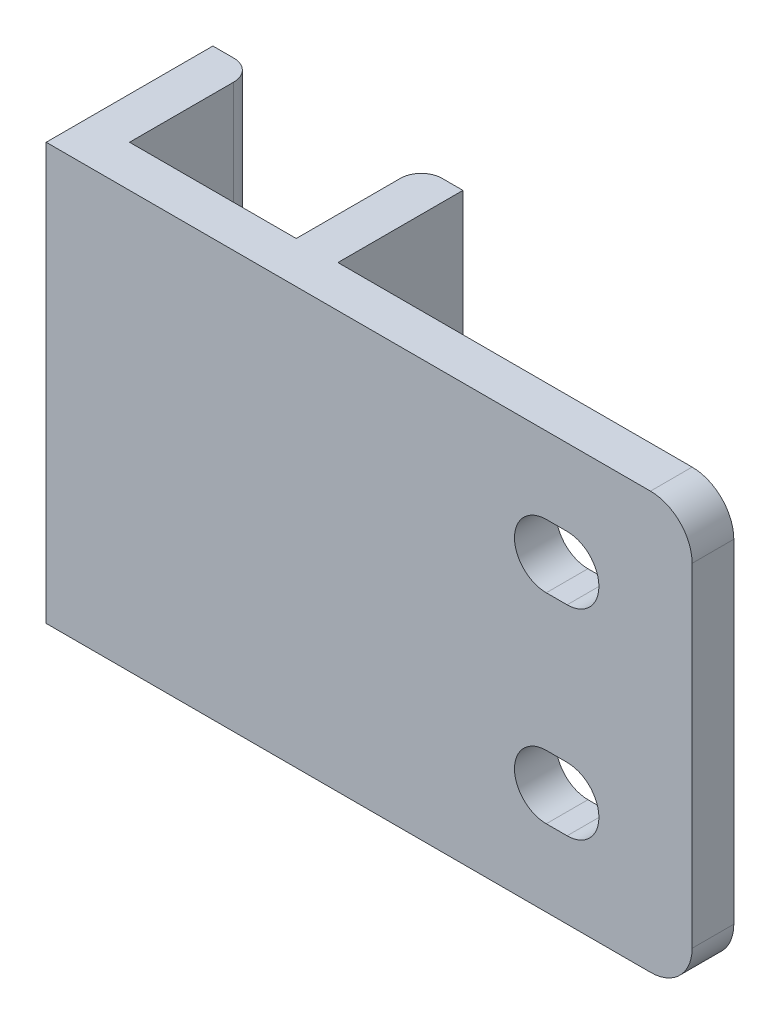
SolidWorks part; units mm, degrees
ref_plane "Plan de face" through (0, 0, 0) normal (0, 0, 1) x (1, 0, 0)
ref_plane "Plan de dessus" through (0, 0, 0) normal (0, 1, 0) x (1, 0, 0)
ref_plane "Plan de droite" through (0, 0, 0) normal (1, 0, 0) x (0, 0, -1)
sketch "Esquisse1" plane through (0, 0, 0) normal (0, 0, 1) x (1, 0, 0)
  line L0 (-30.5, 10) -> (0.5, 10)
  line L1 (-6.5, -4.8) -> (-5.5, -4.8) construction
  line L2 (-6.5, -3.275) -> (-5.5, -3.275)
  line L3 (-6.5, 4.8) -> (-5.5, 4.8) construction
  line L4 (-6.5, 6.325) -> (-5.5, 6.325)
  line L5 (-6.5, 3.275) -> (-5.5, 3.275)
  line L6 (0.5, 0) -> (-6, 0) construction
  line L7 (-6.5, 4.8) -> (-30.5, 4.8) construction
  line L10 (-6.5, -4.8) -> (-5.5, -4.8) construction
  line L11 (-6.5, -6.325) -> (-5.5, -6.325)
  line L12 (0.5, 10) -> (0.5, -10)
  line L13 (-6, 0) -> (-6, 4.8) construction
  line L14 (0.5, 10) -> (0.5, -10) construction
  line L15 (0.5, -10) -> (-30.5, -10)
  line L16 (-30.5, 10) -> (-30.5, -10)
  arc A0 (-6.5, 6.325) -> (-6.5, 3.275) centre (-6.5, 4.8) ccw
  circle A1 centre (-6, 4.8) radius 1.5 construction
  circle A2 centre (-6, -4.8) radius 1.5 construction
  arc A3 (-5.5, 3.275) -> (-5.5, 6.325) centre (-5.5, 4.8) ccw
  arc A4 (-6.5, -3.275) -> (-6.5, -6.325) centre (-6.5, -4.8) ccw
  arc A5 (-5.5, -6.325) -> (-5.5, -3.275) centre (-5.5, -4.8) ccw
  point P0 (-6, 4.8)
  point P11 (-6, -4.8)
extrude "Boss.-Extru.1" add sketch "Esquisse1" along normal blind 2
sketch "Esquisse3" plane through (0, 0, 0) normal (0, 0, 1) x (1, 0, 0)
  line L0 (-30.5, -10) -> (0.5, -10) construction
  line L1 (-30.5, 10) -> (-28.5, 10)
  line L2 (-30.5, 10) -> (-30.5, -10)
  line L3 (-30.5, -10) -> (-28.5, -10)
  line L4 (-28.5, 10) -> (-28.5, -10)
  line L5 (-28.5, 0) -> (-20.5, 0) construction
  line L6 (0.5, 10) -> (-30.5, 10) construction
  line L7 (-20.5, 10) -> (-18.5, 10)
  line L8 (-20.5, 10) -> (-20.5, -10)
  line L9 (-20.5, -10) -> (-18.5, -10)
  line L10 (-18.5, 10) -> (-18.5, -10)
extrude "Boss.-Extru.2" add sketch "Esquisse3" against normal blind 6
fillet "Congé1" radius 1 2 edges at (-28.5, 0, -6) (-20.5, 0, -6)
fillet "Congé2" radius 2 2 edges at (0.5, -10, 1) (0.5, 10, 1)
